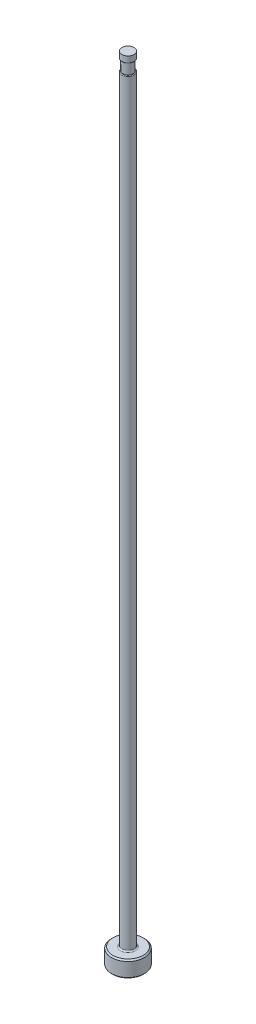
SolidWorks part; units mm, degrees
ref_plane "Front Plane" through (0, 0, 0) normal (0, 0, 1) x (1, 0, 0)
ref_plane "Top Plane" through (0, 0, 0) normal (0, 1, 0) x (1, 0, 0)
ref_plane "Right Plane" through (0, 0, 0) normal (1, 0, 0) x (0, 0, -1)
other "Configuration Table"
sketch "Sketch1" plane through (0, 0, 0) normal (0, 0, 1) x (1, 0, 0)
  line L0 (0, 259.9588) -> (0, -15.1925) construction
  line L1 (0, 0) -> (-3.175, 0)
  line L2 (-3.175, 0) -> (-3.175, 3.175)
  line L3 (-3.175, 3.175) -> (-1.19, 3.175)
  line L4 (-1.19, 3.175) -> (-1.19, 152.4)
  line L5 (-1.19, 152.4) -> (0, 152.4)
  line L6 (0, 152.4) -> (0, 0)
  dimension "L" = 152.4
  dimension "H" = 6.35
  dimension "T" = 3.175
  dimension "D" = 2.38
revolve "Revolve1" add sketch "Sketch1" angle 360 about L0
chamfer "Chamfer1" distance 0.254 angle 45 2 edges at (0, 3.175, 3.175) (0, 0, 3.175)
fillet "Fillet1" radius 0.254 1 edges at (0, 3.175, 1.19)
sketch "Sketch2" plane through (0, 0, 0) normal (0, 0, 1) x (1, 0, 0)
  line L0 (-1.19, 152.4) -> (-1.19, 3.429) construction
  line L1 (-1.19, 151.13) -> (-0.9868, 151.13)
  line L2 (-1.19, 151.13) -> (-1.19, 149.098)
  line L3 (-1.19, 149.098) -> (-0.9868, 149.098)
  line L4 (-0.9868, 151.13) -> (-0.9868, 149.098)
  line L5 (1.19, 152.4) -> (-1.19, 152.4) construction
  line L6 (0, 153.4483) -> (0, 147.3282) construction
  dimension "D1" = 2.032
  dimension "N" = 1.27
  dimension "FD" = 0.2032
  dimension "D3" = 1.9736
revolve "Vent Relief" cut sketch "Sketch2" angle 360 about L6
sketch "Sketch3" plane through (0, 0, 0) normal (0, 0, 1) x (1, 0, 0)
  line L0 (-0.9868, 150.114) -> (-0.9868, 86.614)
  line L1 (-0.9868, 151.13) -> (-0.9868, 149.098) construction
  line L2 (-1.19, 149.098) -> (-1.19, 3.429) construction
  line L3 (-1.19, 85.4964) -> (-1.19, 150.114)
  line L4 (-1.19, 150.114) -> (-0.9868, 150.114)
  arc A0 (-0.9868, 86.614) -> (-1.19, 85.4964) centre (-4.1618, 86.614) cw
  dimension "D1" = 3.175
  dimension "D2" = 63.5
extrude "D-Slot" cut sketch "Sketch3" against normal through all both and the other way through all
sketch "Sketch5" plane through (0, 0, 0) normal (0, 0, 1) x (1, 0, 0)
  line L0 (-1.19, 151.13) -> (1.19, 151.13) construction
  line L1 (-1.19, 152.4) -> (-1.1709, 152.4)
  line L2 (-1.19, 152.4) -> (-1.19, 151.13)
  line L3 (-1.19, 151.13) -> (-1.1709, 151.13)
  line L4 (-1.1709, 152.4) -> (-1.1709, 151.13)
  line L5 (0, 152.6877) -> (0, 150.5771) construction
  dimension "VP" = 0.019
revolve "Vent Diameter" cut sketch "Sketch5" angle 360 about L5
fillet "Fillet2" radius 0.127 2 edges at (1.19, 149.098, 0) (0, 151.13, 1.1709)
sketch "Pocket Sketch" plane through (0, 0, 0) normal (0, 0, 1) x (1, 0, 0)
  line L0 (-3.5719, 0) -> (-3.5719, 3.2004)
  line L1 (-3.5719, 3.2004) -> (-2.1504, 3.2004)
  line L2 (-1.3884, 3.9624) -> (-1.3884, 22.225)
  line L3 (-1.3884, 22.225) -> (0, 22.225)
  line L4 (0, 22.225) -> (0, 0)
  line L5 (0, 0) -> (-3.5719, 0)
  line L6 (0, 12.6104) -> (0, -2.4989) construction
  line L7 (-3.175, 2.921) -> (-3.175, 0.254) construction
  line L8 (2.921, 3.175) -> (-2.921, 3.175) construction
  line L9 (-1.19, 85.4964) -> (-1.19, 3.429) construction
  line L10 (-2.1504, 3.2004) -> (-1.3884, 3.9624)
  point P3 (-1.3884, 3.2004)
  dimension "D1" = 7.1437
  dimension "D2" = 0.3969
  dimension "D3" = 0.0254
  dimension "D4" = 0.1984
  dimension "D5" = 2.7769
  dimension "D6" = 22.225
